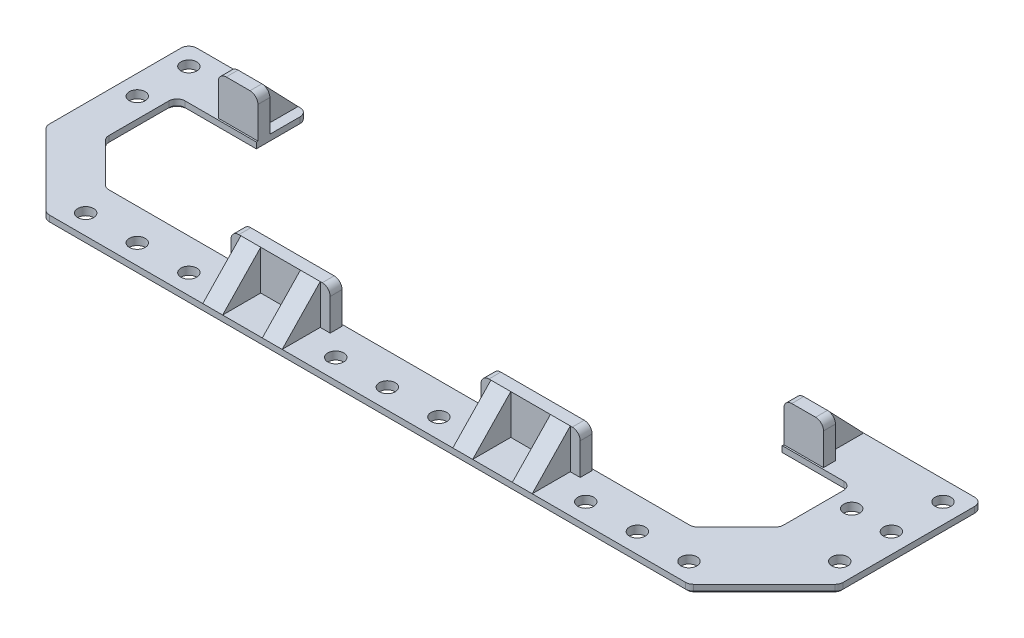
SolidWorks part; units mm, degrees
ref_plane "Спереди" through (0, 0, 0) normal (0, 0, 1) x (1, 0, 0)
ref_plane "Сверху" through (0, 0, 0) normal (0, 1, 0) x (1, 0, 0)
ref_plane "Справа" through (0, 0, 0) normal (1, 0, 0) x (0, 0, -1)
sketch "Эскиз2" plane through (0, 0, 0) normal (0, 1, 0) x (1, 0, 0)
  line L0 (0, 0) -> (0, 93.5103) construction
  line L1 (0, 0) -> (171.2135, 0) construction
  line L3 (95, 0) -> (-95, 0)
  line L4 (95, 0) -> (95, 29)
  line L5 (95, 29) -> (-95, 29)
  line L6 (-95, 0) -> (-95, 29)
  circle A0 centre (90, 24) radius 2
  circle A1 centre (-90, 24) radius 2
  dimension "D2" = 4
  dimension "D1" = 180
  dimension "D3" = 5
  dimension "D4" = 24
  dimension "D5" = 29
extrude "Бобышка-Вытянуть1" add sketch "Эскиз2" along normal blind 2
sketch "Эскиз4" plane through (0, 0, 0) normal (0, 1, 0) x (1, 0, 0)
  line L0 (-90, 24) -> (-90, 44.2955) construction
  line L1 (-90, 24) -> (-90, -24.8043) construction
  line L2 (-90, -8) -> (100, -8) construction
  line L3 (100, -19.3026) -> (100, 49.5434) construction
  line L4 (-85, 29) -> (-85, 42)
  line L5 (95, 29) -> (-95, 29) construction
  line L6 (-85, 42) -> (-95, 42)
  line L7 (-95, 42) -> (-95, 29)
  line L8 (-90, 37) -> (100, 37) construction
  line L9 (5, 37) -> (5, 57.9536) construction
  line L10 (-85, 29) -> (-85, 11)
  line L11 (-85, 11) -> (-74, 0)
  line L12 (-74, 0) -> (74, 0)
  line L13 (74, 0) -> (85, 11)
  line L14 (85, 11) -> (85, 29)
  line L15 (85, 29) -> (98, 42)
  line L16 (98, 42) -> (105, 42)
  line L17 (105, 42) -> (105, 6)
  line L18 (105, 6) -> (86, -13)
  line L19 (86, -13) -> (-76, -13)
  line L20 (-76, -13) -> (-95, 6)
  line L21 (-95, 29) -> (-95, 0) construction
  line L22 (-95, 6) -> (-95, 29)
  line L23 (0, 0) -> (0, 23.239) construction
  line L24 (-95, 0) -> (95, 0) construction
  line L26 (-85, 42) -> (-65, 42)
  line L27 (-85, 42) -> (-85, 29)
  line L28 (-85, 29) -> (-65, 29)
  line L29 (-65, 42) -> (-65, 29)
  line L30 (67.5, 29) -> (98, 29)
  line L31 (67.5, 29) -> (67.5, 42)
  line L32 (67.5, 42) -> (98, 42)
  line L33 (98, 29) -> (98, 42)
  circle A0 centre (-90, 37) radius 2
  circle A1 centre (-90, 24) radius 2 construction
  circle A2 centre (-90, 11) radius 2
  circle A3 centre (-71, -8) radius 2
  circle A4 centre (-58, -8) radius 2
  circle A5 centre (-45, -8) radius 2
  circle A6 centre (100, 37) radius 2
  circle A7 centre (100, 24) radius 2
  circle A8 centre (100, 11) radius 2
  circle A9 centre (55, -8) radius 2
  circle A10 centre (68, -8) radius 2
  circle A11 centre (81, -8) radius 2
  circle A12 centre (-8, -8) radius 2
  circle A13 centre (5, -8) radius 2
  circle A14 centre (18, -8) radius 2
  circle A15 centre (90, 24) radius 2 construction
  circle A16 centre (90, 24) radius 2
  circle A17 centre (-90, 24) radius 2
  point P67 (-76, -8)
  point P68 (-90, 6)
  dimension "D1" = 4
  dimension "D5" = 4
  dimension "D24" = 5
  dimension "D21" = 5
  dimension "D26" = 22.5
  dimension "D2" = 13
  dimension "D3" = 13
  dimension "D4" = 19
  dimension "D6" = 19
  dimension "D7" = 13
  dimension "D8" = 13
  dimension "D9" = 190
  dimension "D10" = 13
  dimension "D11" = 19
  dimension "D12" = 13
  dimension "D13" = 13
  dimension "D14" = 13
  dimension "D15" = 13
  dimension "D16" = 37
  dimension "D17" = 5
  dimension "D18" = 5
  dimension "D19" = 5
  dimension "D20" = 5
  dimension "D22" = 5
  dimension "D23" = 5
  dimension "D25" = 20
sketch "Эскиз5" plane through (0, 2, 0) normal (0, 1, 0) x (1, 0, 0)
  line L0 (-95, 6) -> (-95, 0)
  line L1 (-95, 0) -> (-89, 0)
  line L2 (-76, -13) -> (-95, 6) construction
  line L3 (-95, 0) -> (95, 0) construction
  line L4 (-89, 0) -> (-95, 6)
  line L5 (-85, 29) -> (85, 29)
  line L6 (85, 29) -> (85, 11)
  line L7 (85, 11) -> (74, 0)
  line L8 (74, 0) -> (-74, 0)
  line L9 (-74, 0) -> (-85, 11)
  line L10 (-85, 11) -> (-85, 29)
extrude "Вырез-Вытянуть1" cut sketch "Эскиз5" against normal through all
extrude "Бобышка-Вытянуть2" add sketch "Эскиз4" along normal blind 2 contours L33 L30 L14 L13 L12 L11 L10 L4 L6 L7 L22 L20 L19 L18 L17 L16 A14 A13 A12 A11 A10 A9 A8 A7 A6 A5 A4 A3 A2 A0 | L29 L26 L4 L28 | L30 L33 L15 | L32 L31 L30 L15
sketch "Эскиз6" plane through (0, 2, 0) normal (0, 1, 0) x (1, 0, 0)
  line L0 (-65, 42) -> (-65, 29) construction
  line L1 (-75, 29.4) -> (-65, 29.4)
  line L2 (-75, 29.4) -> (-75, 32.4)
  line L3 (-75, 32.4) -> (-65, 32.4)
  line L4 (-65, 29.4) -> (-65, 32.4)
  line L5 (-65, 42) -> (-95, 42) construction
  line L6 (-72.5, 32.4) -> (-67.5, 32.4)
  line L7 (-72.5, 32.4) -> (-72.5, 42)
  line L8 (-72.5, 42) -> (-67.5, 42)
  line L9 (-67.5, 32.4) -> (-67.5, 42)
  line L10 (5, -13) -> (5, 67.1224) construction
  line L15 (86, -13) -> (-76, -13) construction
  line L17 (-39, -0.4) -> (-14, -0.4)
  line L18 (-39, -0.4) -> (-39, -3.4)
  line L19 (-39, -3.4) -> (-14, -3.4)
  line L20 (-14, -0.4) -> (-14, -3.4)
  line L21 (-45, -8) -> (-8, -8) construction
  line L22 (-36.5, -3.4) -> (-31.5, -3.4)
  line L23 (-36.5, -3.4) -> (-36.5, -13)
  line L24 (-36.5, -13) -> (-31.5, -13)
  line L25 (-31.5, -3.4) -> (-31.5, -13)
  line L26 (-21.5, -3.4) -> (-16.5, -3.4)
  line L27 (-21.5, -3.4) -> (-21.5, -13)
  line L28 (-21.5, -13) -> (-16.5, -13)
  line L29 (-16.5, -3.4) -> (-16.5, -13)
  line L30 (-26.5, -8) -> (-26.5, 1.2) construction
  line L31 (-36.5, -3.4) -> (-36.5, -13)
  line L32 (-31.5, -13) -> (-36.5, -13)
  line L33 (-31.5, -3.4) -> (-31.5, -13)
  line L34 (-31.5, -3.4) -> (-36.5, -3.4)
  line L35 (-21.5, -3.4) -> (-21.5, -13)
  line L36 (-16.5, -13) -> (-21.5, -13)
  line L37 (-16.5, -3.4) -> (-16.5, -13)
  line L38 (-16.5, -3.4) -> (-21.5, -3.4)
  line L39 (-39, -0.4) -> (-39, -3.4)
  line L40 (-14, -0.4) -> (-14, -3.4)
  line L41 (36.5, -8) -> (36.5, 1.2) construction
  line L42 (24, -0.4) -> (24, -3.4)
  line L43 (49, -0.4) -> (49, -3.4)
  line L44 (26.5, -3.4) -> (31.5, -3.4)
  line L45 (26.5, -3.4) -> (26.5, -13)
  line L46 (26.5, -13) -> (31.5, -13)
  line L47 (31.5, -3.4) -> (31.5, -13)
  line L48 (41.5, -3.4) -> (46.5, -3.4)
  line L49 (41.5, -3.4) -> (41.5, -13)
  line L50 (41.5, -13) -> (46.5, -13)
  line L51 (46.5, -3.4) -> (46.5, -13)
  line L52 (26.5, -3.4) -> (26.5, -13)
  line L53 (31.5, -13) -> (26.5, -13)
  line L54 (31.5, -3.4) -> (31.5, -13)
  line L55 (31.5, -3.4) -> (26.5, -3.4)
  line L56 (41.5, -3.4) -> (41.5, -13)
  line L57 (46.5, -13) -> (41.5, -13)
  line L58 (46.5, -3.4) -> (46.5, -13)
  line L59 (46.5, -3.4) -> (41.5, -3.4)
  line L60 (24, -0.4) -> (24, -3.4)
  line L61 (49, -3.4) -> (24, -3.4)
  line L62 (49, -0.4) -> (49, -3.4)
  line L63 (49, -0.4) -> (24, -0.4)
  line L64 (67.5, 29.4) -> (77.5, 29.4)
  line L65 (67.5, 29.4) -> (67.5, 32.4)
  line L66 (67.5, 32.4) -> (77.5, 32.4)
  line L67 (77.5, 29.4) -> (77.5, 32.4)
  line L68 (70, 32.4) -> (75, 32.4)
  line L69 (70, 32.4) -> (70, 42)
  line L70 (70, 42) -> (75, 42)
  line L71 (75, 32.4) -> (75, 42)
  line L72 (67.5, 42) -> (105, 42) construction
  line L73 (-85, 29) -> (-65, 29) construction
  line L74 (-74, 0) -> (74, 0) construction
  line L75 (67.5, 29) -> (85, 29) construction
  line L76 (67.5, 29) -> (67.5, 42) construction
  point P38 (-26.5, -3.4)
  point P61 (0, 0)
  point P62 (0, 0)
  point P64 (0, 0)
  point P67 (0, 0)
  point P70 (0, 0)
  point P71 (0, 0)
  point P72 (-39, -3.2769)
  point P73 (0, 0)
  point P74 (0, 0)
  dimension "D1" = 0.4
  dimension "D2" = 5
  dimension "D3" = 2.5
  dimension "D4" = 25
  dimension "D5" = 2.5
  dimension "D6" = 0.4
  dimension "D7" = 5
  dimension "D8" = 10
  dimension "D9" = 2.5
  dimension "D10" = 0.4
  dimension "D11" = 3
  dimension "D12" = 10
  dimension "D13" = 3
extrude "Бобышка-Вытянуть3" add sketch "Эскиз6" along normal blind 10 contours L3 L9 L7 M18 | L3 L2 L1 M17 | L20 L17 L18 L19 | L29 L19 L27 M21 | L25 L19 L23 M21 | L43 L63 L42 L61 L44 L48 | L47 L44 L45 M21 | L51 L48 L49 M21 | L66 L71 L69 M24 | L64 L67 L66 M25
sketch "Эскиз8" plane through (75, 0, 0) normal (1, 0, 0) x (0, 0, -1)
  line L0 (32.4, 12) -> (42, 2)
  line L1 (42, 2) -> (42, 12)
  line L2 (42, 12) -> (32.4, 12)
  line L3 (-13, 12) -> (-13, 2)
  line L4 (-13, 2) -> (-3.4, 12)
  line L5 (-3.4, 12) -> (-13, 12)
extrude "Вырез-Вытянуть2" cut sketch "Эскиз8" against normal through all
fillet "Скругление1" radius 2 8 edges at (-75, 12, -30.9) (-65, 12, -30.9) (-39, 12, 1.9) (-14, 12, 1.9) (67.5, 12, -30.9) (77.5, 12, -30.9) (49, 12, 1.9) (24, 12, 1.9)
fillet "Скругление3" radius 2 14 edges at (105, 1, -42) (67.5, 1, -42) (85, 1, -29) (85, 1, -11) (74, 1, 0) (105, 1, -6) (86, 1, 13) (-76, 1, 13) (-95, 1, -6) (-74, 1, 0) (-85, 1, -11) (-85, 1, -29) (-65, 1, -42) (-95, 1, -42)
chamfer "Фаска1" distance 0.5 angle 45 30 edges at (-74, 0, -29) (-84.4142, 0, -28.4142) (-85, 0, -19.4142) (-84.8478, 0, -11.0631) (-79.5, 0, -5.5) (-73.9369, 0, -0.1522) (0, 0, 0) (73.9369, 0, -0.1522) (79.5, 0, -5.5) (84.8478, 0, -11.0631) (85, 0, -19.4142) (84.4142, 0, -28.4142) (75.25, 0, -29) (-65, 0, -34.5) (-65.5858, 0, -41.4142) (-80, 0, -42) (-94.4142, 0, -41.4142) (67.5, 0, -34.5) (-95, 0, -23.4142) (68.0858, 0, -41.4142) (-94.8478, 0, -6.0631) (86.25, 0, -42) (-85.5, 0, 3.5) (104.4142, 0, -41.4142) (-75.9369, 0, 12.8478) (105, 0, -23.4142) (5, 0, 13) (104.8478, 0, -6.0631) (85.9369, 0, 12.8478) (95.5, 0, 3.5)
